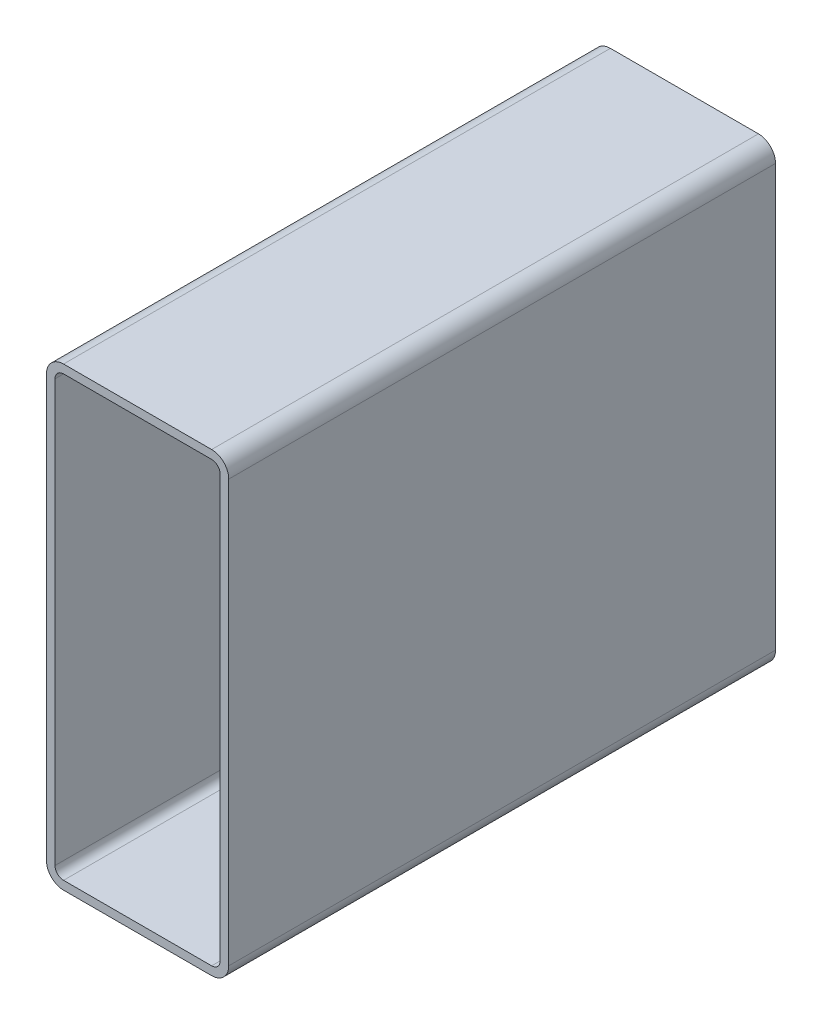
SolidWorks part; units mm, degrees
ref_plane "Front Plane" through (0, 0, 0) normal (0, 0, 1) x (1, 0, 0)
ref_plane "Top Plane" through (0, 0, 0) normal (0, 1, 0) x (1, 0, 0)
ref_plane "Right Plane" through (0, 0, 0) normal (1, 0, 0) x (0, 0, -1)
sketch "Sketch1" plane through (0, 0, 0) normal (0, 0, 1) x (1, 0, 0)
sketch_block_instance "HSS10x4x0.1875-1"
sketch_block "HSS10x4x0.1875"
extrude "Boss-Extrude1" add sketch "Sketch1" along normal blind 304.8
